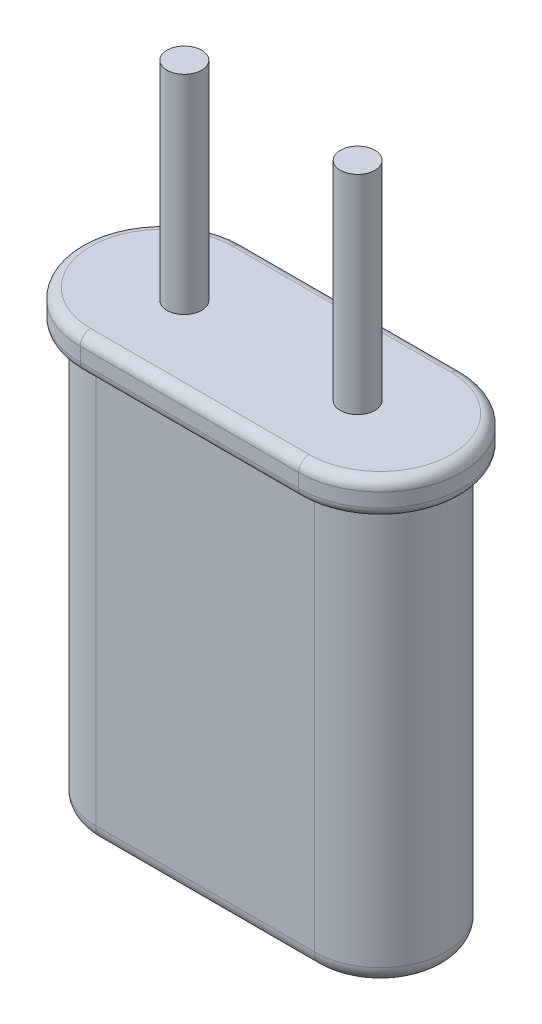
SolidWorks part; units mm, degrees
ref_plane "Front Plane" through (0, 0, 0) normal (0, 0, 1) x (1, 0, 0)
ref_plane "Top Plane" through (0, 0, 0) normal (0, 1, 0) x (1, 0, 0)
ref_plane "Right Plane" through (0, 0, 0) normal (1, 0, 0) x (0, 0, -1)
sketch "Sketch1" plane through (0, 0, 0) normal (0, 1, 0) x (-1, 0, 0)
  line L0 (3.15, -2.35) -> (-3.15, -2.35)
  line L1 (3.15, 2.35) -> (-3.15, 2.35)
  line L2 (0, 2.35) -> (0, 0) construction
  line L3 (-5.5, 0) -> (0, 0) construction
  arc A0 (-3.15, 2.35) -> (-3.15, -2.35) centre (-3.15, 0) ccw
  arc A1 (3.15, 2.35) -> (3.15, -2.35) centre (3.15, 0) cw
  point P7 (0, -2.35)
  dimension "D2" = 2.35
  dimension "D3" = 3.15
extrude "Extrude1" add sketch "Sketch1" against normal blind 1
sketch "Sketch2" plane through (0, -1, 0) normal (0, -1, 0) x (1, 0, 0)
  line L4 (-3.15, -1.9) -> (3.15, -1.9)
  line L5 (3.15, 1.9) -> (-3.15, 1.9)
  line L8 (-3.15, -1.9) -> (3.15, -1.9)
  line L9 (3.15, 1.9) -> (-3.15, 1.9)
  arc A4 (3.15, -1.9) -> (3.15, 1.9) centre (3.15, 0) ccw
  arc A7 (-3.15, 1.9) -> (-3.15, -1.9) centre (-3.15, 0) ccw
  arc A8 (3.15, -1.9) -> (3.15, 1.9) centre (3.15, 0) ccw
  arc A9 (-3.15, 1.9) -> (-3.15, -1.9) centre (-3.15, 0) ccw
  point P16 (0, 0)
  dimension "D1" = 0.45
extrude "Extrude2" add sketch "Sketch2" along normal blind 12
fillet "Fillet1" radius 0.3 8 edges at (-5.5, 0, 0) (0, 0, 2.35) (5.5, 0, 0) (5.5, -1, 0) (-5.5, -1, 0) (0, -1, 2.35) (0, 0, -2.35) (0, -1, -2.35)
fillet "Fillet2" radius 0.5 4 edges at (0, -13, -1.9) (-5.05, -13, 0) (0, -13, 1.9) (5.05, -13, 0)
sketch "Sketch3" plane through (0, 0, 0) normal (0, 1, 0) x (-1, 0, 0)
  line L0 (0, 2.5207) -> (0, -2.7663) construction
  circle A0 centre (2.5, 0) radius 0.5
  circle A1 centre (-2.5, 0) radius 0.5
  point P5 (0, 0)
  dimension "D1" = 1
  dimension "D2" = 2.5
extrude "Extrude3" add sketch "Sketch3" along normal blind 6
